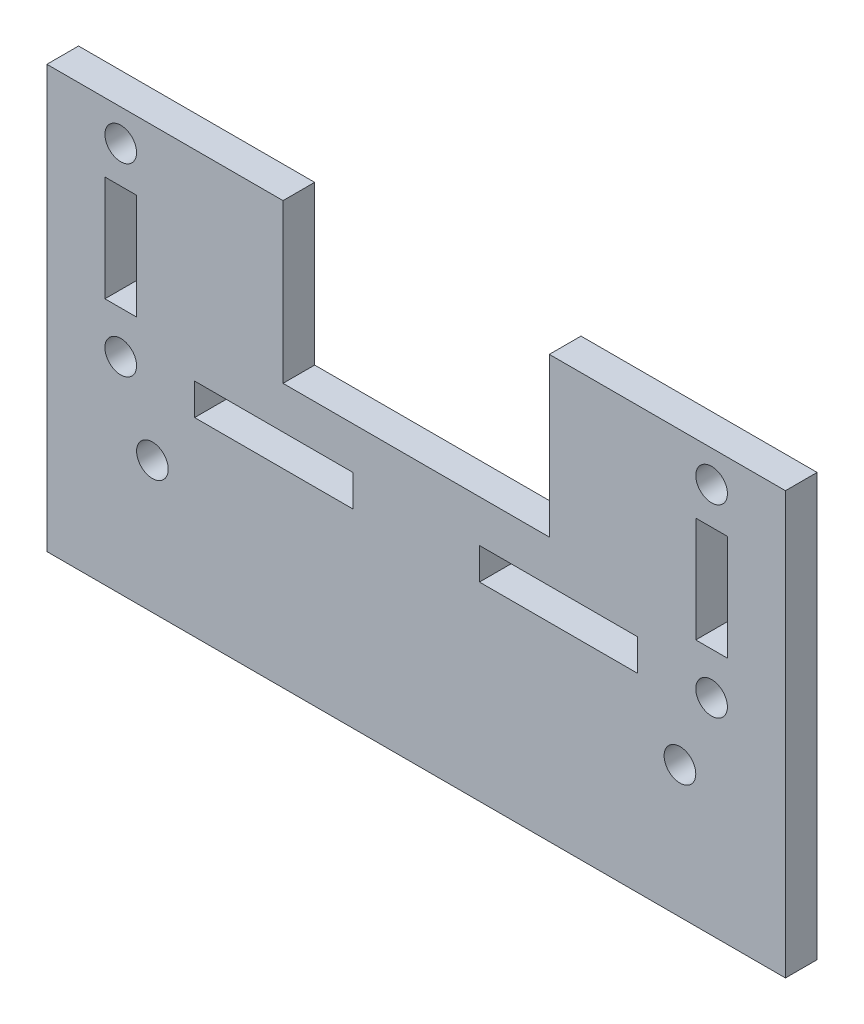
SolidWorks part; units mm, degrees
ref_plane "Front Plane" through (0, 0, 0) normal (0, 0, 1) x (1, 0, 0)
ref_plane "Top Plane" through (0, 0, 0) normal (0, 1, 0) x (1, 0, 0)
ref_plane "Right Plane" through (0, 0, 0) normal (1, 0, 0) x (0, 0, -1)
sketch "Sketch1" plane through (0, 0, 0) normal (0, 0, 1) x (1, 0, 0)
  line L1 (-35, -12.5) -> (35, -12.5)
  line L2 (-35, -12.5) -> (-35, 12.5)
  line L3 (-35, 12.5) -> (35, 12.5)
  line L4 (35, -12.5) -> (35, 12.5)
  line L5 (-35, -12.5) -> (35, 12.5) construction
  line L6 (-35, 12.5) -> (35, -12.5) construction
  line L7 (-35, 12.5) -> (35, 12.5)
  line L8 (-35, 12.5) -> (-35, 27.5)
  line L9 (-35, 27.5) -> (35, 27.5)
  line L10 (35, 12.5) -> (35, 27.5)
  line L11 (-5, 20) -> (5, 20)
  line L12 (-5, 20) -> (-5, 13)
  line L13 (-5, 13) -> (5, 13)
  line L14 (5, 20) -> (5, 13)
  line L15 (-5, 20) -> (5, 13) construction
  line L16 (-5, 13) -> (5, 20) construction
  line L17 (-12.6204, 12.5) -> (12.6204, 12.5)
  line L18 (-12.6204, 12.5) -> (-12.6204, 27.5)
  line L19 (-12.6204, 27.5) -> (12.6204, 27.5)
  line L20 (12.6204, 12.5) -> (12.6204, 27.5)
  line L21 (-12.6204, 12.5) -> (12.6204, 27.5) construction
  line L22 (-12.6204, 27.5) -> (12.6204, 12.5) construction
  circle A0 centre (0, 0) radius 4.7625
  circle A1 centre (-25, 0) radius 1.5
  circle A2 centre (25, 0) radius 1.5
  point P11 (0, 16.5)
  point P18 (0, 20)
  dimension "D1" = 9.525
  dimension "D2" = 3
  dimension "D3" = 3
  dimension "D6" = 25
  dimension "D4" = 25
  dimension "D5" = 70
  dimension "D7" = 25
  dimension "D8" = 15
  dimension "D9" = 10
  dimension "D10" = 7
  dimension "D11" = 20
extrude "Boss-Extrude1" add sketch "Sketch1" along normal blind 3 contours L3 L18 L9 L8 | L20 L3 L10 L9 | L1 L4 L3 L7 L2 A2 A1 A0 | A0
sketch "Sketch2" plane through (0, 0, 3) normal (0, 0, 1) x (1, 0, 0)
  line L0 (-21.15, 5.5) -> (21.15, 5.5) construction
  line L1 (-35, 27.5) -> (-12.6204, 27.5) construction
  line L2 (21.15, -995.6644) -> (21.15, 49004.3356) construction
  line L3 (35, -12.5) -> (35, 27.5) construction
  line L4 (-21.15, -995.6644) -> (-21.15, 49004.3356) construction
  line L6 (-35, -12.5) -> (-35, 27.5) construction
  dimension "D1" = 22
  dimension "D2" = 13.85
  dimension "D3" = 13.85
sketch "Sketch3" plane through (0, 0, 3) normal (0, 0, 1) x (1, 0, 0)
  line L0 (21.15, -988.296) -> (21.15, 49011.704) construction
  line L1 (-21.15, -989.9706) -> (-21.15, 49010.0294) construction
  line L2 (-35, -12.5) -> (35, -12.5)
  line L3 (35, -12.5) -> (35, 27.5)
  line L4 (35, 27.5) -> (-35, 27.5)
  line L5 (-35, 27.5) -> (-35, -12.5)
  line L6 (-1017.5682, 5.5) -> (48982.4318, 5.5) construction
  line L7 (-1021, 7) -> (48979, 7) construction
  line L8 (-21, 5.5) -> (-6, 5.5)
  line L9 (-21, 5.5) -> (-21, 8.5)
  line L10 (-21, 8.5) -> (-6, 8.5)
  line L11 (-6, 5.5) -> (-6, 8.5)
  line L12 (6, 5.5) -> (21, 5.5)
  line L13 (6, 5.5) -> (6, 8.5)
  line L14 (6, 8.5) -> (21, 8.5)
  line L15 (21, 5.5) -> (21, 8.5)
  line L16 (0, -1000) -> (0, 49000) construction
  line L17 (26.5, 11) -> (29.5, 11)
  line L18 (26.5, 11) -> (26.5, 21)
  line L19 (26.5, 21) -> (29.5, 21)
  line L20 (29.5, 11) -> (29.5, 21)
  line L21 (26.5, 11) -> (29.5, 21) construction
  line L22 (26.5, 21) -> (29.5, 11) construction
  line L23 (-26.5, 21) -> (-29.5, 11) construction
  line L24 (-26.5, 11) -> (-29.5, 21) construction
  line L25 (-29.5, 11) -> (-29.5, 21)
  line L26 (-26.5, 21) -> (-29.5, 21)
  line L27 (-26.5, 11) -> (-26.5, 21)
  line L28 (-26.5, 11) -> (-29.5, 11)
  circle A0 centre (-28, 7) radius 1.5
  circle A1 centre (28, 7) radius 1.5
  circle A2 centre (28, 24.5) radius 1.5
  circle A3 centre (-28, 24.5) radius 1.5
  point P24 (28, 16)
  point P40 (-28, 16)
  dimension "D7" = 3
  dimension "D13" = 3
  dimension "D1" = 22
  dimension "D2" = 13.85
  dimension "D3" = 13.85
  dimension "D4" = 3
  dimension "D5" = 15
  dimension "D6" = 15
  dimension "D8" = 7
  dimension "D9" = 7
  dimension "D10" = 3
  dimension "D11" = 10
  dimension "D12" = 4
  dimension "D14" = 3
extrude "Cut-Extrude1" cut sketch "Sketch3" against normal blind 10 contours L28 L27 L26 L25 | A3 | A0 | L8 L11 L10 L9 | L12 L15 L14 L13 | L17 L20 L19 L18 | A2 | A1
